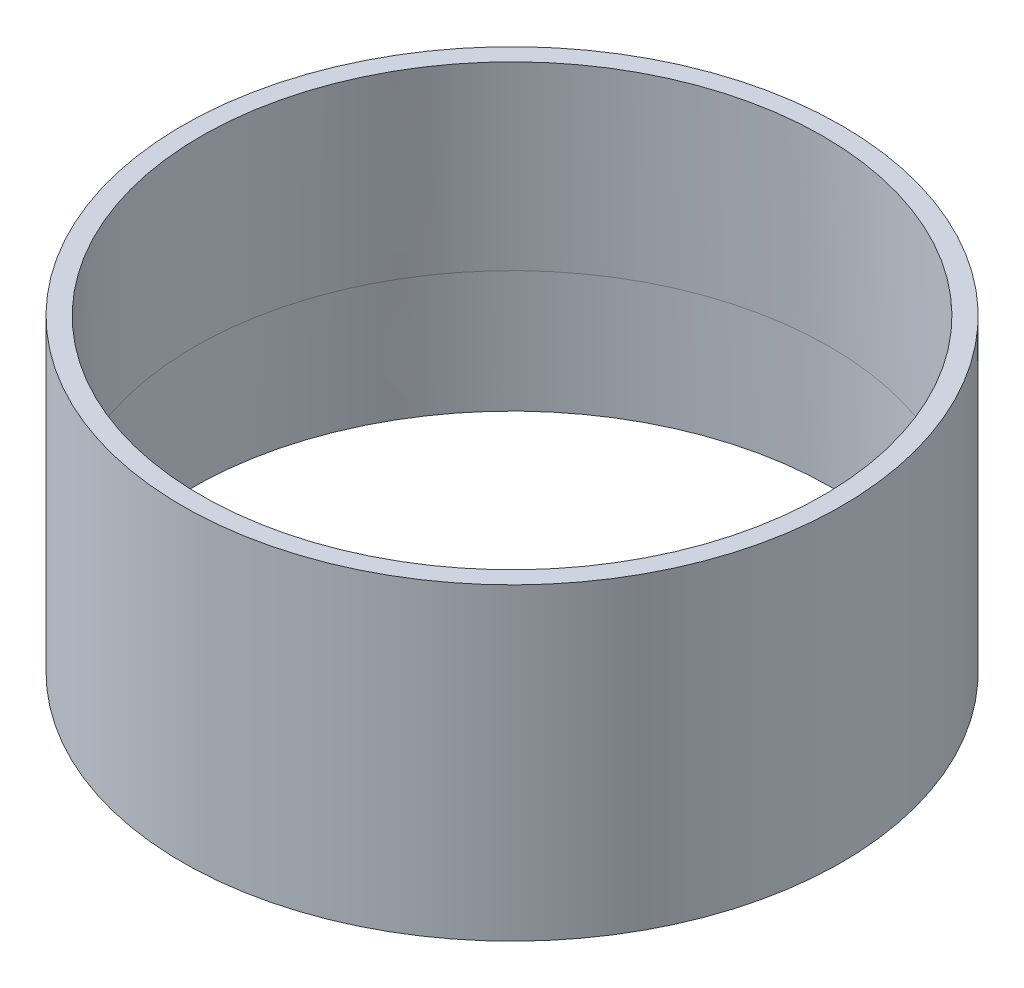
SolidWorks part; units mm, degrees
ref_plane "Płaszczyzna przednia" through (0, 0, 0) normal (0, 0, 1) x (1, 0, 0)
ref_plane "Płaszczyzna górna" through (0, 0, 0) normal (0, 1, 0) x (1, 0, 0)
ref_plane "Płaszczyzna prawa" through (0, 0, 0) normal (1, 0, 0) x (0, 0, -1)
sketch "Szkic1" plane through (0, 0, 0) normal (0, 0, 1) x (1, 0, 0)
  line L0 (0, 0) -> (0, 60) construction
  line L1 (27.5, 0) -> (27.5, 60) construction
  line L2 (26.8, 0) -> (26.8, 60) construction
  line L3 (26.8, 60) -> (27.5, 60) construction
  line L5 (25.2, 60) -> (25.7, 44.998)
  line L7 (25.9, 35) -> (26.7, 35)
  line L9 (-26.8, 0) -> (-26.8, 60) construction
  line L10 (-27.5, 0) -> (-27.5, 60) construction
  line L11 (26.7, 0) -> (26.7, 57) construction
  line L12 (25.9, 35) -> (25.7, 44.998)
  line L13 (0, 35) -> (25.5, 35) construction
  line L14 (25.5, 35) -> (25.5, 34.2508) construction
  line L15 (25.5, 34.2508) -> (0, 34.2508) construction
  line L16 (27.5, 34.8299) -> (26.3, 34.8299) construction
  line L17 (26.3, 34.8299) -> (26.3, 31.8469) construction
  line L20 (26.7, 0) -> (26.7, 60) construction
  line L21 (25.2, 60) -> (26.7, 60)
  line L23 (26.7, 60) -> (26.7, 35)
  dimension "D1" = 27.5
  dimension "D3" = 9.998
  dimension "D4" = 0.8
  dimension "D5" = 25
  dimension "D6" = 0.1
  dimension "D7" = 26.8
  dimension "D8" = 60
  dimension "D9" = 1.5
  dimension "D11" = 25.5
  dimension "D12" = 53.6
  dimension "D2" = 0.7
  dimension "D13" = 25.5
revolve "Obrót1" add sketch "Szkic1" angle 360 about L0
